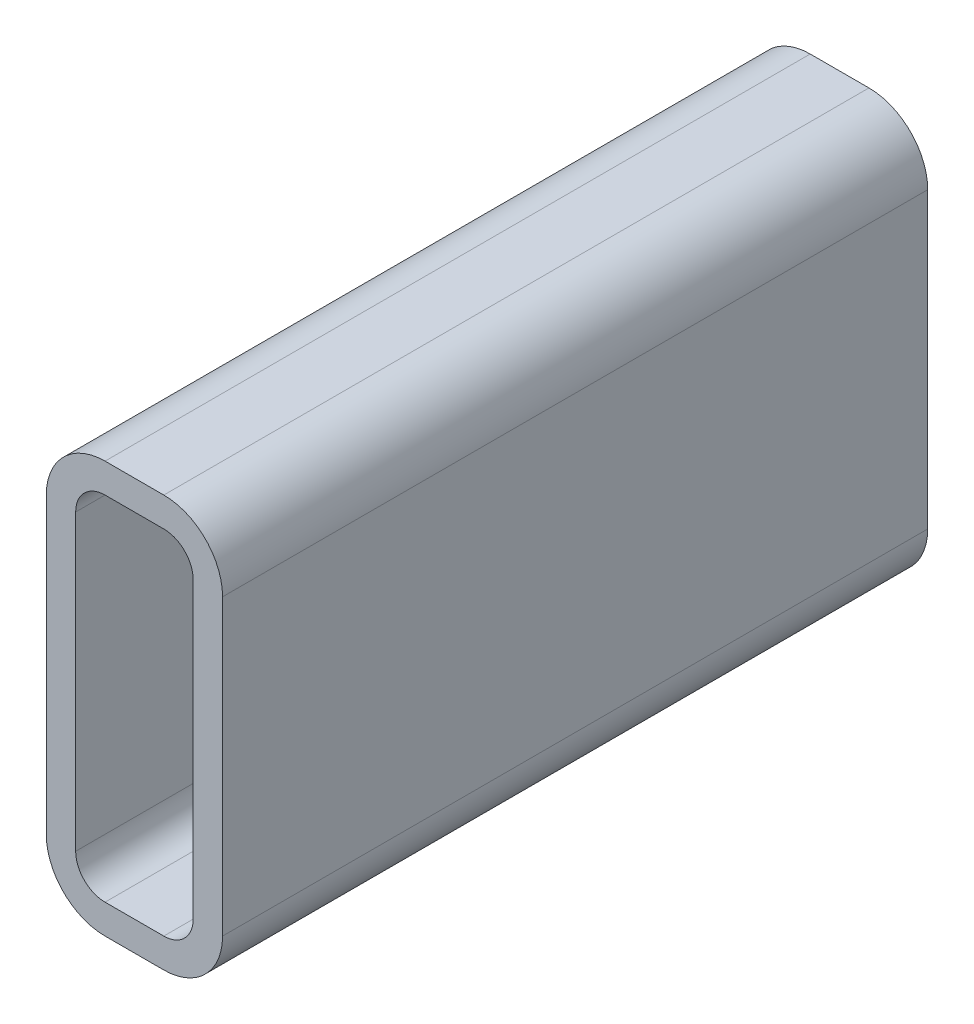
SolidWorks part; units mm, degrees
ref_plane "Front Plane" through (0, 0, 0) normal (0, 0, 1) x (1, 0, 0)
ref_plane "Top Plane" through (0, 0, 0) normal (0, 1, 0) x (1, 0, 0)
ref_plane "Right Plane" through (0, 0, 0) normal (1, 0, 0) x (0, 0, -1)
sketch "Sketch1" plane through (0, 0, 0) normal (0, 0, 1) x (1, 0, 0)
sketch_block_instance "HSS7x3x0.500-1"
sketch_block "HSS7x3x0.500"
extrude "Boss-Extrude1" add sketch "Sketch1" along normal blind 304.8
